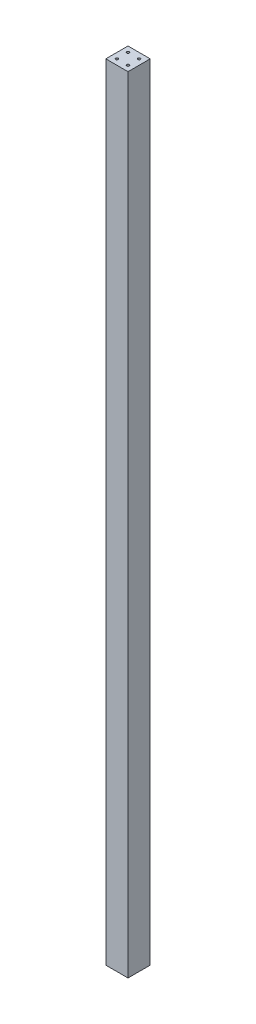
SolidWorks part; units mm, degrees
ref_plane "前视基准面" through (0, 0, 0) normal (0, 0, 1) x (1, 0, 0)
ref_plane "上视基准面" through (0, 0, 0) normal (0, 1, 0) x (1, 0, 0)
ref_plane "右视基准面" through (0, 0, 0) normal (1, 0, 0) x (0, 0, -1)
other "Configuration Table"
sketch "草图1" plane through (0, 0, 0) normal (0, 1, 0) x (1, 0, 0)
  line L1 (-30, 30) -> (30, 30)
  line L2 (-30, 30) -> (-30, -30)
  line L3 (-30, -30) -> (30, -30)
  line L4 (30, 30) -> (30, -30)
  line L5 (-30, 30) -> (30, -30) construction
  line L6 (-30, -30) -> (30, 30) construction
  point P0 (0, 0)
extrude "凸台-拉伸1" add sketch "草图1" along normal blind 2120
sketch "草图2" plane through (0, 0, 30) normal (0, 0, 1) x (1, 0, 0)
  line L0 (-30, 60) -> (30, 60)
  line L1 (-30, 2120) -> (-30, 0) construction
  line L2 (30, 2120) -> (30, 0) construction
  line L3 (-30, 0) -> (30, 0) construction
  line L4 (-30, 2060) -> (30, 2060)
  line L5 (-30, 2120) -> (30, 2120) construction
  dimension "D1" = 60
  dimension "D2" = 60
sketch "草图4" plane through (0, 0, 30) normal (0, 0, 1) x (1, 0, 0)
  line L0 (0, 2060) -> (0, 60)
  line L1 (-30, 2060) -> (30, 2060) construction
  line L2 (-30, 60) -> (30, 60) construction
sketch "草图5" plane through (0, 0, 0) normal (0, -1, 0) x (1, 0, 0)
  line L0 (30, 30) -> (30, -30) construction
  line L1 (30, -30) -> (-30, -30) construction
  point P0 (15, -15)
  dimension "D1" = 15
  dimension "D2" = 15
hole_wizard "M8 螺纹孔1" positions "草图6" profile "草图7" tap size "M8" standard "GB"
sketch "草图6" plane through (0, 0, 0) normal (0, -1, 0) x (-1, 0, 0)
  point P0 (-15, 15)
sketch "草图7" plane through (15, 0, -15) normal (1, 0, 0) x (0, 0, -1)
  line L0 (0, 0) -> (0, 19.75)
  line L1 (0, 19.75) -> (3.4, 17.7071)
  line L2 (3.4, 17.7071) -> (3.4, 0)
  line L5 (3.4, 0) -> (0, 0)
  line L10 (0, 19.75) -> (-3.4, 17.7071) construction
  line L11 (0, -6.35) -> (0, 107.95) construction
  dimension "螺纹孔钻头直径" = 6.8
  dimension "螺纹孔钻头深度" = 19.75
  dimension "导头角度" = 118
pattern_linear "阵列(线性)1" count 2 spacing 30 along (-1, 0, 0) count 2 spacing 30 along (0, 0, 1) of "M8 螺纹孔1"
hole_wizard "M8 螺纹孔2" positions "草图9" profile "草图10" tap size "M8" standard "GB"
sketch "草图9" plane through (0, 2120, 0) normal (0, 1, 0) x (1, 0, 0)
  point P0 (15, 15)
sketch "草图10" plane through (15, 2120, -15) normal (1, 0, 0) x (0, 0, 1)
  line L0 (0, 0) -> (0, 19.75)
  line L1 (0, 19.75) -> (3.4, 17.7071)
  line L2 (3.4, 17.7071) -> (3.4, 0)
  line L5 (3.4, 0) -> (0, 0)
  line L10 (0, 19.75) -> (-3.4, 17.7071) construction
  line L11 (0, -6.35) -> (0, 107.95) construction
  dimension "螺纹孔钻头直径" = 6.8
  dimension "螺纹孔钻头深度" = 19.75
  dimension "导头角度" = 118
pattern_linear "阵列(线性)2" count 2 spacing 30 along (-1, 0, 0) count 2 spacing 30 along (0, 0, 1) of "M8 螺纹孔2"
sketch "草图11" plane through (0, 0, 30) normal (0, 0, 1) x (1, 0, 0)
  line L0 (30, 2120) -> (30, 0) construction
  line L1 (-30, 0) -> (30, 0) construction
  line L2 (-30, 2120) -> (-30, 0) construction
  line L3 (-30, 2120) -> (30, 2120) construction
  point P0 (15, 290)
  point P5 (-15, 290)
  point P8 (15, 1830)
  point P9 (-15, 1830)
  dimension "D1" = 15
  dimension "D2" = 290
  dimension "D3" = 15
  dimension "D4" = 290
  dimension "D5" = 290
sketch "草图14" plane through (0, 0, 30) normal (0, 0, 1) x (1, 0, 0)
  line L0 (-30, 0) -> (30, 0) construction
  line L1 (-30, 2120) -> (30, 2120) construction
  line L3 (-30, 2120) -> (-30, 0) construction
  point P0 (-15, 315)
  point P1 (-15, 345)
  point P2 (-15, 1805)
  point P3 (-15, 1775)
  dimension "D1" = 345
  dimension "D2" = 15
  dimension "D3" = 345
  dimension "D4" = 15
  dimension "D5" = 30
  dimension "D6" = 15
  dimension "D7" = 15
  dimension "D8" = 30
